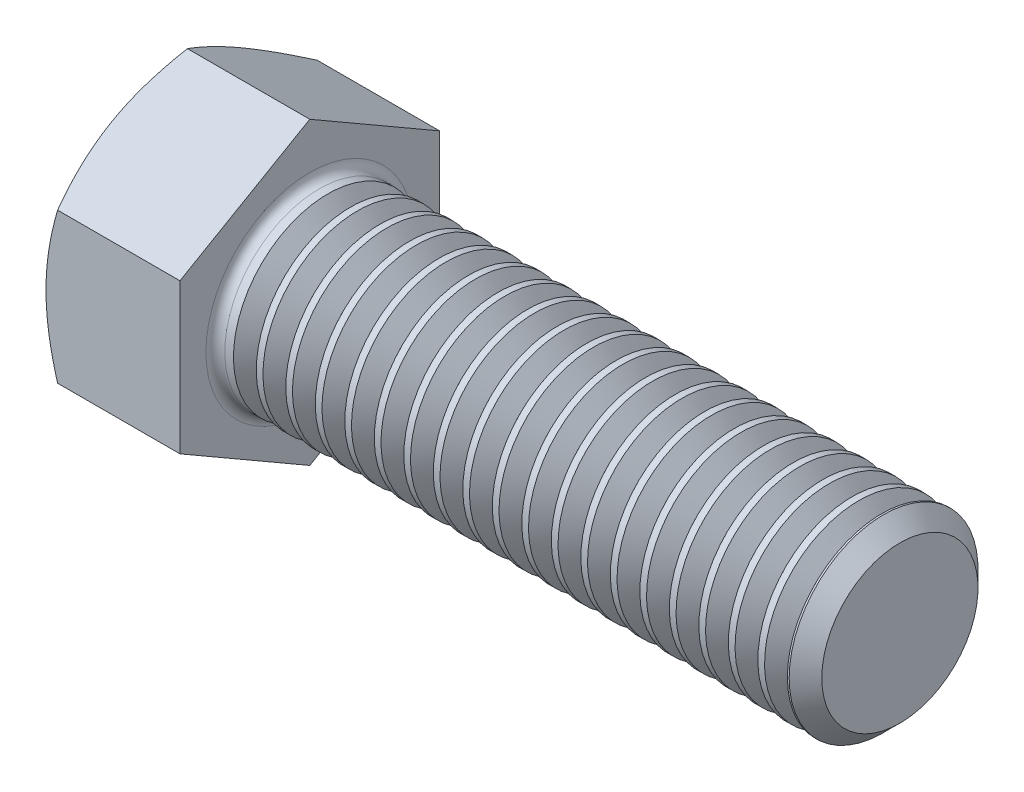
SolidWorks part; units mm, degrees
ref_plane "Plane1" through (0, 0, 0) normal (0, 0, 1) x (1, 0, 0)
ref_plane "Plane2" through (0, 0, 0) normal (0, 1, 0) x (1, 0, 0)
ref_plane "Plane3" through (0, 0, 0) normal (1, 0, 0) x (0, 0, -1)
extrude "BaseHead" add sketch "Sketch1" along normal blind 5.675
sketch "Sketch1" plane through (0, 0, 0) normal (1, 0, 0) x (0, 0, -1)
  line L0 (5.5, 3.1754) -> (5.5, -3.1754)
  line L1 (-5.5, 3.1754) -> (-5.5, -3.1754)
  line L2 (5.5, -3.1754) -> (0, -6.3509)
  line L3 (0, -6.3509) -> (-5.5, -3.1754)
  line L4 (5.5, 3.1754) -> (0, 6.3509)
  line L5 (0, 6.3509) -> (-5.5, 3.1754)
  dimension "Width_flats" = 11
  dimension "D2" = 120
  dimension "D3" = 5.5
  dimension "D4" = 5.5
  dimension "D5" = 5.5
revolve "BaseBody" add sketch "BodySke"
sketch "BodySke" plane through (0, 0, 0) normal (0, 0, 1) x (1, 0, 0)
  line L0 (0, 3.1754) -> (0, -3.1754) construction
  line L1 (0, 0) -> (30.675, 0)
  line L2 (0, 0) -> (0, 4)
  line L3 (0, 4) -> (29.9845, 4)
  line L4 (30.675, 0) -> (30.675, 3.3095)
  line L5 (5.675, 6.3509) -> (5.675, 3.1754) construction
  line L6 (30.675, 3.3095) -> (29.9845, 4)
  line L7 (0, 0) -> (96.52, 0) construction
  line L8 (30.675, -3.3095) -> (29.9845, -4) construction
  line L9 (0, -4) -> (29.9845, -4) construction
  line L10 (6.925, 15.24) -> (6.925, -1.27) construction
  line L12 (5.675, 3.1754) -> (5.675, -3.1754) construction
  dimension "Length" = 25
  dimension "Body_ch_ang" = 45
  dimension "Diameter" = 8
  dimension "Minor_dia" = 6.619
  dimension "Advance" = 1.25
fillet "HeadFillet" radius 0.4 1 edges at (5.675, 0, -4)
sketch "Sketch3" plane through (0, 0, 0) normal (0, 0, 1) x (1, 0, 0)
  line L0 (0, 5.5) -> (3.378, 11.3509)
  line L1 (0, 6.3509) -> (0, 3.1754) construction
  line L2 (3.378, 11.3509) -> (3.378, 16.3509)
  line L3 (3.378, 16.3509) -> (-10, 16.3509)
  line L4 (-10, 16.3509) -> (-10, 5.5)
  line L5 (-10, 5.5) -> (0, 5.5)
  line L6 (0, 0) -> (99.06, 0) construction
  line L7 (5.675, 6.3509) -> (0, 6.3509) construction
  dimension "D1" = 5.5
  dimension "D2" = 5
  dimension "D3" = 10
  dimension "D4" = 5
  dimension "Head_ch_ang" = 30
revolve "HeadChamfer" cut sketch "Sketch3" angle 360 about L6
sketch "Sketch4" plane through (0, 0, 0) normal (0, 0, 1) x (1, 0, 0)
  line L1 (5.675, 6.3509) -> (5.675, 3.1754) construction
  line L2 (5.675, 5.5) -> (5.075, 5.5)
  line L3 (5.675, 5.5) -> (5.675, 16.3509)
  line L4 (5.675, 16.3509) -> (5.075, 16.3509)
  line L5 (0, 0) -> (95.25, 0) construction
  line L6 (0, 0) -> (96.52, 0) construction
  line L7 (5.075, 5.5) -> (5.075, 16.3509)
  line L8 (5.675, 6.3509) -> (0.4912, 6.3509) construction
  dimension "D1" = 11
  dimension "D2" = 10
  dimension "Bearing_ht" = 0.6
revolve "BearingFace" cut sketch "Sketch4" angle 360 about L5
sketch "ThdSchSke" plane through (0, 0, 0) normal (0, 0, 1) x (1, 0, 0)
  line L0 (6.925, -3.3095) -> (6.4415, -4)
  line L1 (6.925, -3.3095) -> (7.4085, -4)
  line L2 (7.4085, -4) -> (7.4085, -5)
  line L3 (-3.175, 0) -> (5.1513, 0) construction
  line L5 (7.4085, -5) -> (6.4415, -5)
  line L6 (6.4415, -5) -> (6.4415, -4)
  dimension "Thread_minor" = 6.619
  dimension "Diameter" = 8
  dimension "Start" = 6.925
  dimension "SideAngle" = 55
  dimension "VeeAngle" = 70
  dimension "Overcut" = 10
revolve "ThreadSchematic" cut sketch "ThdSchSke" angle 360 about L3
pattern_linear "ThdSchPat" count 19 spacing 1.25 along (1, 0, 0) of "ThreadSchematic"
equation "\"D3@Sketch1\" = \"Width_flats@Sketch1\" / 2"
equation "\"D4@Sketch1\" = \"D3@Sketch1\""
equation "\"D5@Sketch1\" = \"D4@Sketch1\""
equation "\"Thread_minor@ThreadCosmetic\" = \"Minor_dia@BodySke\""
equation "\"D1@Sketch3\" = \"Width_flats@Sketch1\" / 2"
equation "\"D1@Sketch4\" = \"Width_flats@Sketch1\""
equation "\"Thread_length@ThreadCosmetic\" = \"Length@BodySke\" - \"Advance@BodySke\""
equation "\"Thread_minor@ThdSchSke\" = \"Minor_dia@BodySke\""
equation "\"Diameter@ThdSchSke\" = \"Diameter@BodySke\""
equation "\"Overcut@ThdSchSke\" = \"Diameter@BodySke\" * 1.25"
equation "\"Start@ThdSchSke\" = \"Head_ht@BaseHead\" + \"Length@BodySke\" - \"Thread_length@ThreadCosmetic\"  '---Non-countersunk---"
equation "\"Num_threads@ThdSchPat\" = int( \"Thread_length@ThreadCosmetic\" / \"Advance@BodySke\" + 0.999 )  + 1"
equation "\"Advance@ThdSchPat\" = \"Thread_length@ThreadCosmetic\" /  (\"Num_threads@ThdSchPat\" - 1) 'relax it"
equation "\"Num_threads@ThdSchPat\" = \"Num_threads@ThdSchPat\" - sgn( \"Num_threads@ThdSchPat\" - 1) '---chamfered tips only---"
